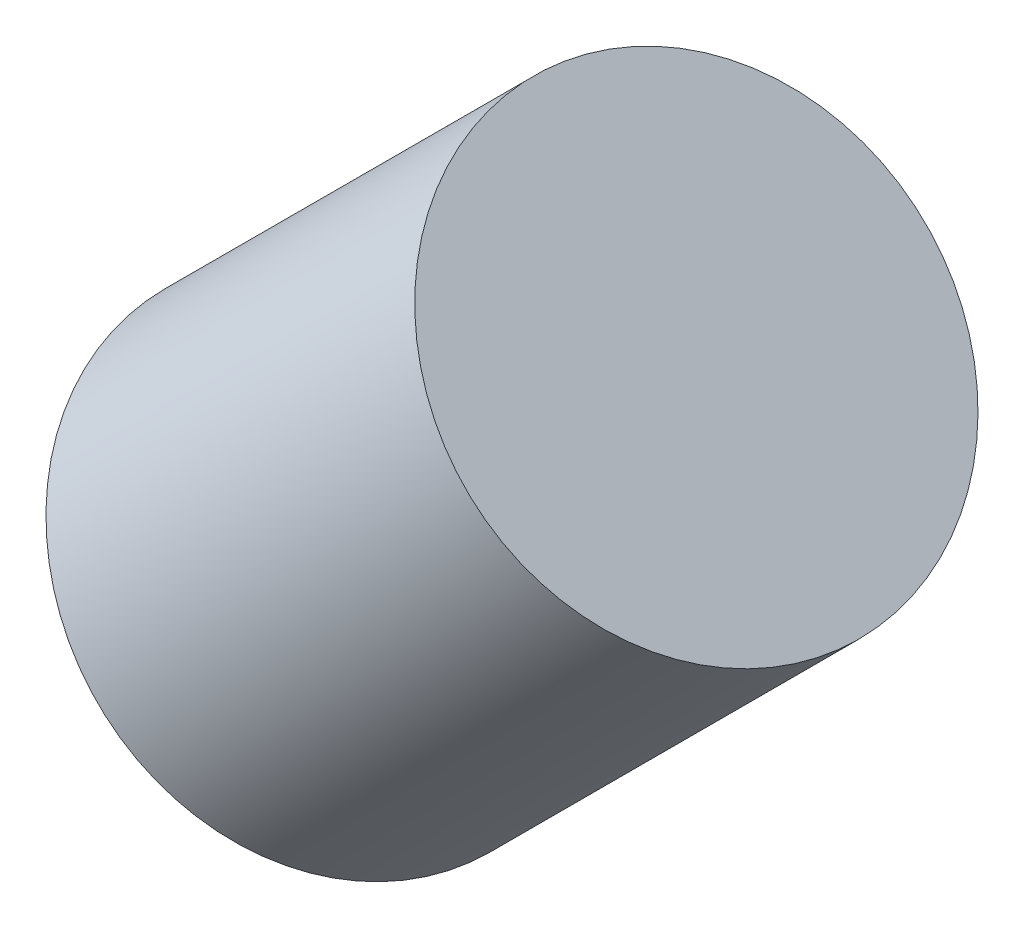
SolidWorks part; units mm, degrees
ref_plane "前视基准面" through (0, 0, 0) normal (0, 0, 1) x (1, 0, 0)
ref_plane "上视基准面" through (0, 0, 0) normal (0, 1, 0) x (1, 0, 0)
ref_plane "右视基准面" through (0, 0, 0) normal (1, 0, 0) x (0, 0, -1)
sketch "草图1" plane through (0, 0, 0) normal (0, 0, 1) x (1, 0, 0)
  line L0 (14.1569, 25) -> (24.5893, 35.4325) construction
  line L1 (17.2041, 30.1686) -> (14.9333, 27.8978) construction
  line L2 (18.3995, 29.2426) -> (17.3389, 30.3033)
  line L3 (17.3389, 30.3033) -> (14.9333, 27.8978)
  line L4 (14.9333, 27.8978) -> (15.5711, 26.4142)
  line L5 (18.3995, 29.2426) -> (15.5711, 26.4142)
  circle A0 centre (14.1569, 25) radius 6 construction
  dimension "D1" = 4
revolve "旋转1" add sketch "草图1" angle 360 about L0
